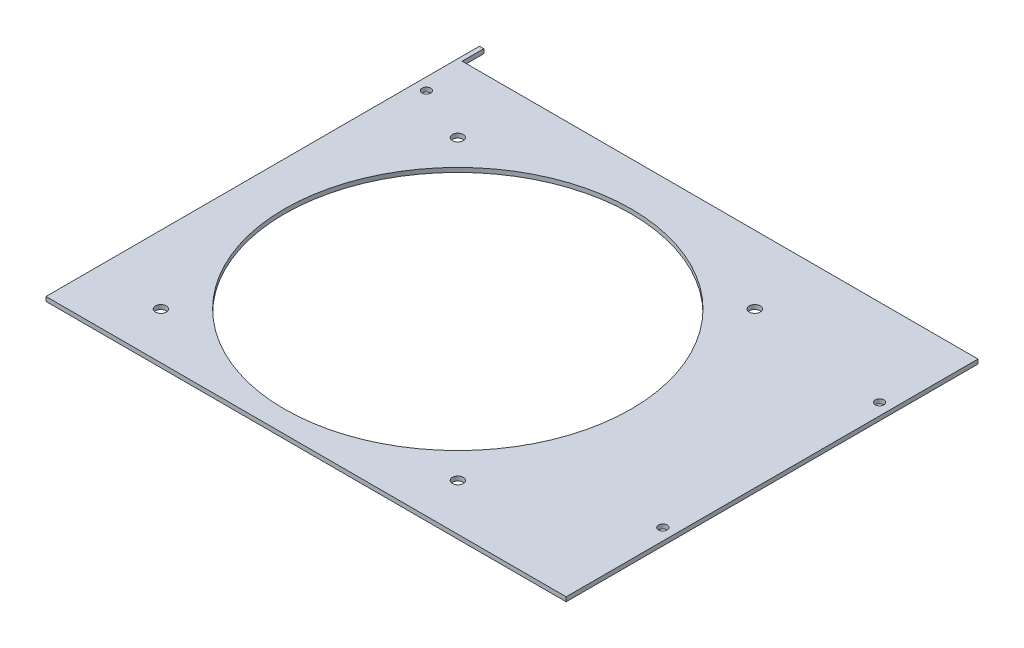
SolidWorks part; units mm, degrees
ref_plane "Front Plane" through (0, 0, 0) normal (0, 0, 1) x (1, 0, 0)
ref_plane "Top Plane" through (0, 0, 0) normal (0, 1, 0) x (1, 0, 0)
ref_plane "Right Plane" through (0, 0, 0) normal (1, 0, 0) x (0, 0, -1)
sketch "Sketch1" plane through (0, 0, 0) normal (0, 1, 0) x (1, 0, 0)
  line L1 (0, -219.4954) -> (-254, -219.4954)
  line L2 (0, -219.4954) -> (0, 34.5046)
  line L3 (0, 34.5046) -> (-254, 34.5046)
  line L4 (-254, -219.4954) -> (-254, 34.5046)
  dimension "D1" = 254
  dimension "D2" = 254
extrude "Boss-Extrude1" add sketch "Sketch1" along normal blind 2.54
sketch "Sketch3" plane through (0, 2.54, 0) normal (0, 1, 0) x (1, 0, 0)
  line L0 (0, -219.4954) -> (0, 34.5046) construction
  line L1 (-63.5, 31.9646) -> (-17.78, 31.9646)
  line L2 (-63.5, 31.9646) -> (-63.5, 11.6446)
  line L3 (-63.5, 11.6446) -> (-17.78, 11.6446)
  line L4 (-17.78, 31.9646) -> (-17.78, 11.6446)
  line L5 (0, 34.5046) -> (-254, 34.5046) construction
  dimension "D1" = 63.5
  dimension "D2" = 22.86
  dimension "D3" = 20.32
  dimension "D4" = 45.72
extrude "Boss-Extrude2" add sketch "Sketch3" along normal blind 20.32
fillet "Fillet1" radius 10.16 2 edges at (-40.64, 22.86, -31.9646) (-40.64, 22.86, -11.6446)
sketch "Sketch4" plane through (0, 2.54, 0) normal (0, 1, 0) x (1, 0, 0)
  line L0 (0, 34.5046) -> (-254, 34.5046) construction
  line L1 (-63.5, 11.6446) -> (-69.85, 11.6446)
  line L2 (-63.5, 11.6446) -> (-63.5, 31.9646)
  line L3 (-63.5, 31.9646) -> (-69.85, 31.9646)
  line L4 (-69.85, 11.6446) -> (-69.85, 31.9646)
  line L5 (-245.11, 11.6446) -> (-251.46, 11.6446)
  line L6 (-245.11, 11.6446) -> (-245.11, 31.9646)
  line L7 (-245.11, 31.9646) -> (-251.46, 31.9646)
  line L8 (-251.46, 11.6446) -> (-251.46, 31.9646)
  line L10 (-254, 34.5046) -> (-254, -219.4954) construction
  point P8 (-66.675, 31.9646)
  dimension "D1" = 2.54
  dimension "D2" = 20.32
  dimension "D3" = 6.35
  dimension "D4" = 6.35
  dimension "D5" = 2.54
  dimension "D6" = 20.32
  dimension "D7" = 6.35
  dimension "D8" = 2.54
extrude "Boss-Extrude3" add sketch "Sketch4" along normal blind 20.32
sketch "Sketch5" plane through (-251.46, 0, 0) normal (-1, 0, 0) x (0, 0, 1)
  line L0 (-31.9646, 22.86) -> (-31.9646, 2.54) construction
  line L2 (-31.9646, 22.86) -> (-11.6446, 22.86) construction
  line L3 (-11.6446, 12.7) -> (-11.6446, 22.86)
  line L4 (-31.9646, 22.86) -> (-21.8046, 22.86)
  line L5 (-31.9646, 22.86) -> (-31.9646, 12.7)
  line L6 (-21.8046, 22.86) -> (-11.6446, 22.86)
  arc A0 (-11.6446, 12.7) -> (-31.9646, 12.7) centre (-21.8046, 12.7) ccw
  circle A1 centre (-21.8046, 12.7) radius 4.826
  point P0 (-21.8046, 12.7)
  dimension "D3" = 9.652
  dimension "D1" = 10.16
  dimension "D2" = 10.16
extrude "Cut-Extrude2" cut sketch "Sketch5" against normal blind 187.96 contours A0 M5 M6 | A0 M4 M5 | A1
sketch "Sketch6" plane through (-69.85, 0, 0) normal (-1, 0, 0) x (0, 0, 1)
  line L0 (-31.9646, 2.54) -> (-11.6446, 2.54) construction
  line L1 (-23.0746, 2.54) -> (-20.5346, 2.54)
  line L2 (-23.0746, 2.54) -> (-23.0746, 4.445)
  line L3 (-23.0746, 4.445) -> (-20.5346, 4.445)
  line L4 (-20.5346, 2.54) -> (-20.5346, 4.445)
  line L5 (-31.9646, 12.7) -> (-31.9646, 2.54) construction
  dimension "D1" = 2.54
  dimension "D2" = 1.905
  dimension "D3" = 8.89
extrude "Boss-Extrude4" add sketch "Sketch6" along normal blind 180.34
sketch "Sketch7" plane through (0, 0, 0) normal (1, 0, 0) x (0, 0, -1)
  line L1 (-219.4954, 0) -> (34.5046, 0)
  line L2 (-219.4954, 0) -> (-219.4954, 2.54)
  line L3 (-219.4954, 2.54) -> (34.5046, 2.54)
  line L4 (34.5046, 0) -> (34.5046, 2.54)
extrude "Boss-Extrude5" add sketch "Sketch7" along normal blind 63.5
sketch "Sketch8" plane through (0, 2.54, 0) normal (0, 1, 0) x (1, 0, 0)
  line L0 (-254, 34.5046) -> (-254, -219.4954) construction
  line L1 (-254, -219.4954) -> (63.5, -219.4954) construction
  circle A0 centre (-127, -105.1954) radius 101.6
  circle A1 centre (-213.995, -18.2004) radius 3.175
  circle A2 centre (-40.005, -18.2004) radius 3.175
  circle A3 centre (-40.005, -192.1904) radius 3.175
  circle A4 centre (-213.995, -192.1904) radius 3.175
  dimension "D1" = 203.2
  dimension "D2" = 127
  dimension "D3" = 114.3
  dimension "D8" = 6.35
  dimension "D9" = 6.35
  dimension "D10" = 6.35
  dimension "D11" = 6.35
  dimension "D6" = 40.005
  dimension "D4" = 173.99
  dimension "D5" = 173.99
  dimension "D7" = 173.99
extrude "Cut-Extrude3" cut sketch "Sketch8" against normal blind 50.8
sketch "Sketch9" plane through (0, 2.54, 0) normal (0, 1, 0) x (1, 0, 0)
  line L0 (-251.46, 31.9646) -> (-251.46, -216.9554)
  line L1 (-254, 34.5046) -> (-251.46, 34.5046)
  line L2 (-254, 34.5046) -> (-254, -219.4954)
  line L3 (-254, -219.4954) -> (63.5, -219.4954)
  line L4 (63.5, 34.5046) -> (63.5, -219.4954)
  line L5 (-251.46, -216.9554) -> (60.96, -216.9554)
  line L6 (60.96, 31.9646) -> (60.96, -216.9554)
  line L7 (0, 31.9646) -> (60.96, 31.9646)
  line L8 (-251.46, 31.9646) -> (-251.46, 34.5046)
  line L9 (0, 31.9646) -> (0, 34.5046)
  line L10 (0, 34.5046) -> (63.5, 34.5046)
  line L12 (-254, 34.5046) -> (63.5, 34.5046) construction
  line L13 (-251.46, 31.9646) -> (60.96, 31.9646) construction
  dimension "D2" = 63.5
  dimension "D1" = 2.54
extrude "Boss-Extrude6" add sketch "Sketch9" along normal blind 58.42
sketch "Sketch16" plane through (0, 0, 216.9554) normal (0, 0, -1) x (-1, 0, 0)
  line L0 (-60.96, 2.54) -> (251.46, 2.54) construction
  line L1 (-60.96, 60.96) -> (0, 60.96)
  line L2 (-60.96, 60.96) -> (-60.96, 2.54)
  line L3 (-60.96, 2.54) -> (0, 2.54)
  line L4 (0, 60.96) -> (0, 2.54)
  circle A0 centre (-31.75, 31.75) radius 25.4
  dimension "D1" = 29.21
  dimension "D2" = 29.21
  dimension "D3" = 50.8
  dimension "2.4" = 60.96
extrude "Boss-Extrude9" add sketch "Sketch16" along normal blind 15.24
sketch "Sketch15" plane through (0, 0, -31.9646) normal (0, 0, 1) x (1, 0, 0)
  line L0 (0, 60.96) -> (63.5, 60.96)
  line L1 (0, 60.96) -> (0, 2.4569)
  line L2 (63.5, 60.96) -> (63.5, 2.4569)
  line L3 (0, 2.4569) -> (63.5, 2.4569)
  line L4 (60.96, 60.96) -> (60.96, 2.54) construction
  circle A0 centre (31.75, 31.6669) radius 25.4
  dimension "D1" = 29.21
  dimension "D2" = 29.21
  dimension "D3" = 50.8
  dimension "D4" = 63.5
extrude "Boss-Extrude8" add sketch "Sketch15" along normal blind 15.24
sketch "Sketch10" plane through (0, 0, -34.5046) normal (0, 0, -1) x (-1, 0, 0)
  line L0 (-63.5, 0) -> (-63.5, 60.96) construction
  line L1 (-63.5, 0) -> (254, 0) construction
  line L6 (-63.5, 60.96) -> (0, 60.96) construction
  line L8 (-45.72, 31.75) -> (-45.72, 60.96)
  line L9 (-45.72, 60.96) -> (-17.78, 60.96)
  line L10 (-17.78, 31.75) -> (-17.78, 60.96)
  arc A0 (-45.72, 31.75) -> (-17.78, 31.75) centre (-31.75, 31.75) ccw
  dimension "D1" = 27.94
  dimension "D2" = 31.75
  dimension "D3" = 31.75
extrude "Cut-Extrude4" cut sketch "Sketch10" against normal blind 279.4
sketch "Sketch11" plane through (0, 2.54, 0) normal (0, 1, 0) x (1, 0, 0)
  line L0 (63.5, -219.4954) -> (63.5, 34.5046) construction
  line L19 (48.26, -24.6774) -> (39.37, -24.6774)
  line L20 (48.26, -24.6774) -> (48.26, -33.5674)
  line L21 (48.26, -33.5674) -> (39.37, -33.5674)
  line L22 (39.37, -24.6774) -> (39.37, -33.5674)
  line L23 (45.72, -219.4954) -> (63.5, -219.4954) construction
  line L24 (48.26, -151.6774) -> (39.37, -151.6774)
  line L25 (48.26, -151.6774) -> (48.26, -160.5674)
  line L26 (48.26, -160.5674) -> (39.37, -160.5674)
  line L27 (39.37, -151.6774) -> (39.37, -160.5674)
  line L28 (63.5, 34.5046) -> (45.72, 34.5046) construction
  line L29 (0, 34.5046) -> (-251.46, 34.5046) construction
  line L30 (-251.46, -216.9554) -> (-251.46, 11.6446) construction
  line L31 (-251.46, -8.0404) -> (-242.57, -8.0404)
  line L32 (-251.46, -8.0404) -> (-251.46, 0.8496)
  line L33 (-251.46, 0.8496) -> (-242.57, 0.8496)
  line L34 (-242.57, -8.0404) -> (-242.57, 0.8496)
  circle A0 centre (-247.015, -3.5954) radius 2.54
  circle A4 centre (43.942, -155.9954) radius 2.54
  circle A5 centre (43.942, -28.9954) radius 2.54
  dimension "D3" = 5.08
  dimension "D4" = 8.89
  dimension "D5" = 4.445
  dimension "D6" = 8.89
  dimension "D9" = 8.89
  dimension "D10" = 5.08
  dimension "D13" = 5.08
  dimension "D14" = 4.572
  dimension "D15" = 4.572
  dimension "D19" = 15.24
  dimension "D20" = 15.24
  dimension "D11" = 4.572
  dimension "D12" = 4.572
  dimension "D18" = 4.445
  dimension "D2" = 8.89
  dimension "D7" = 8.89
  dimension "D8" = 8.89
  dimension "D16" = 63.5
  dimension "D17" = 63.5
  dimension "1.5" = 38.1
extrude "Boss-Extrude7" add sketch "Sketch11" along normal blind 58.42
sketch "Sketch12" plane through (0, 60.96, 0) normal (0, 1, 0) x (1, 0, 0)
  line L0 (45.72, -219.4954) -> (63.5, -219.4954) construction
  line L1 (63.5, 34.5046) -> (45.72, 34.5046) construction
  circle A0 centre (-247.015, -3.5954) radius 2.54
  circle A4 centre (43.942, -28.9954) radius 2.54
  circle A5 centre (43.942, -155.9954) radius 2.54
  circle A6 centre (43.942, -155.9954) radius 2.54 construction
  circle A7 centre (43.942, -28.9954) radius 2.54 construction
  dimension "D3" = 5.08
  dimension "D4" = 5.08
  dimension "D5" = 5.08
  dimension "D7" = 0
  dimension "D6" = 0
  dimension "D1" = 63.5
  dimension "D2" = 63.5
extrude "Cut-Extrude5" cut sketch "Sketch12" against normal blind 76.2
sketch "Sketch20" plane through (0, 2.54, 0) normal (0, 1, 0) x (1, 0, 0)
  line L1 (-312.4345, 72.1673) -> (137.9039, 72.1673)
  line L2 (-312.4345, 72.1673) -> (-312.4345, -260.707)
  line L3 (-312.4345, -260.707) -> (137.9039, -260.707)
  line L4 (137.9039, 72.1673) -> (137.9039, -260.707)
extrude "Cut-Extrude7" cut sketch "Sketch20" along normal blind 76.2
sketch "Sketch21" plane through (0, 2.54, 0) normal (0, 1, 0) x (1, 0, 0)
  line L0 (63.5, 34.5046) -> (-254, 34.5046) construction
  line L1 (-251.46, 34.5046) -> (0, 34.5046)
  line L2 (-251.46, 34.5046) -> (-251.46, 21.8046)
  line L3 (-251.46, 21.8046) -> (0, 21.8046)
  line L4 (0, 34.5046) -> (0, 21.8046)
  line L5 (63.5, -219.4954) -> (63.5, 34.5046) construction
  line L6 (-254, 34.5046) -> (-254, -219.4954) construction
  dimension "D1" = 12.7
  dimension "D2" = 63.5
  dimension "D3" = 2.54
extrude "Cut-Extrude8" cut sketch "Sketch21" against normal blind 76.2
sketch "Sketch22" plane through (0, 2.54, 0) normal (0, 1, 0) x (1, 0, 0)
  line L0 (-254, -219.4954) -> (63.5, -219.4954) construction
  line L1 (0, 21.8046) -> (50.8, 21.8046)
  line L2 (0, 21.8046) -> (0, 34.5046)
  line L3 (0, 34.5046) -> (63.5, 34.5046)
  line L4 (63.5, 21.8046) -> (63.5, 34.5046)
  line L6 (63.5, 21.8046) -> (63.5, -219.4954)
  line L7 (63.5, -219.4954) -> (50.8, -219.4954)
  line L8 (50.8, 21.8046) -> (50.8, -219.4954)
  dimension "D1" = 12.7
extrude "Cut-Extrude9" cut sketch "Sketch22" against normal blind 2.54
